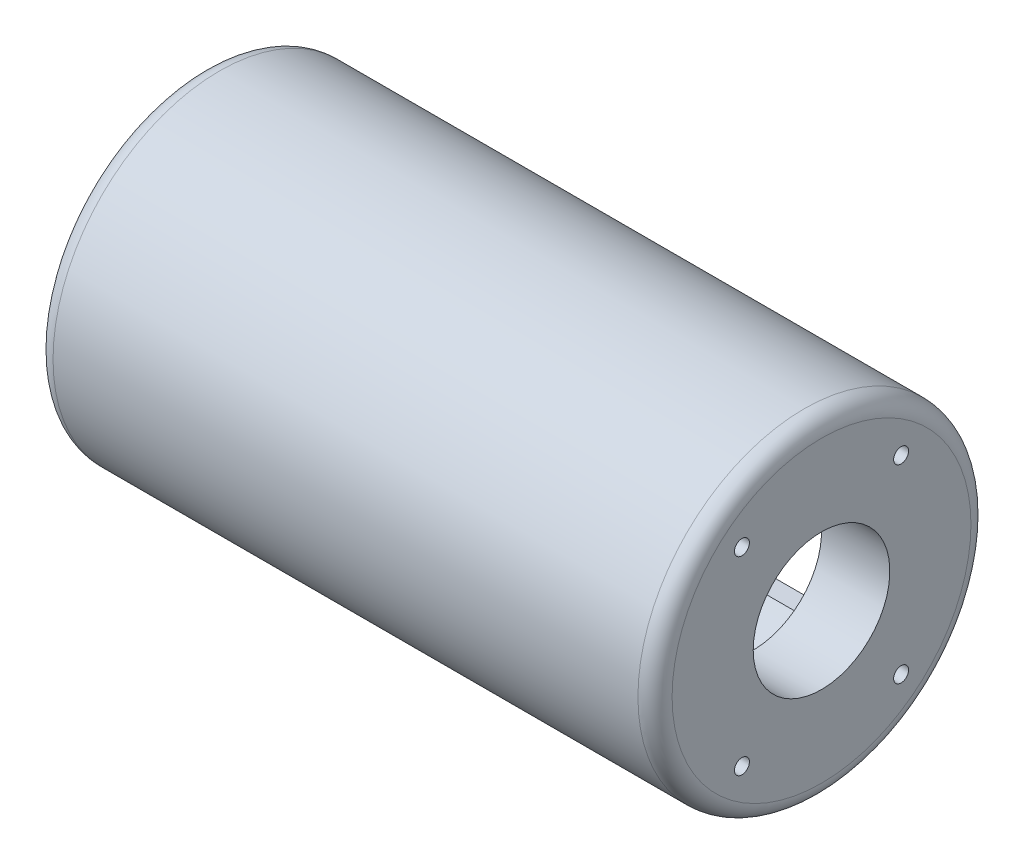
SolidWorks part; units mm, degrees
ref_plane "Face" through (0, 0, 0) normal (0, 0, 1) x (1, 0, 0)
ref_plane "Dessus" through (0, 0, 0) normal (0, 1, 0) x (1, 0, 0)
ref_plane "Droite" through (0, 0, 0) normal (1, 0, 0) x (0, 0, -1)
sketch "Esquisse1" plane through (0, 0, 0) normal (0, 0, 1) x (1, 0, 0)
  line L0 (0, 0) -> (122.7324, 0) construction
  line L1 (0, 6.5) -> (0, 39)
  line L2 (0, 39) -> (145, 39)
  line L3 (145, 39) -> (145, 16)
  line L4 (16, 36) -> (129, 36)
  line L5 (129, 36) -> (129, 16)
  line L6 (129, 16) -> (145, 16)
  line L7 (16, 36) -> (16, 6.5)
  line L8 (16, 6.5) -> (0, 6.5)
  dimension "D1" = 145
  dimension "D2" = 39
  dimension "D3" = 13
  dimension "D4" = 32
  dimension "D5" = 3
  dimension "D6" = 16
  dimension "D7" = 16
  dimension "D8" = 129
revolve "Base-Révolution" add sketch "Esquisse1" angle 360 about L0
fillet "Congé1" radius 4
sketch "Esquisse2" plane through (145, 0, 0) normal (1, 0, 0) x (0, 0, -1)
  line L0 (0, 57.3867) -> (0, -53.5947) construction
  line L1 (-57.0075, 0) -> (63.8333, 0) construction
  line L2 (0, 0) -> (37.2817, 44.4306) construction
  circle A0 centre (18.6408, 22.2153) radius 1.75
  circle A1 centre (-18.6408, 22.2153) radius 1.75
  circle A2 centre (18.6408, -22.2153) radius 1.75
  circle A3 centre (-18.6408, -22.2153) radius 1.75
  dimension "D1" = 3.5
  dimension "D2" = 29
  dimension "D3" = 40
extrude "Enlèv. mat.-Extru.1" cut sketch "Esquisse2" against normal blind 20
sketch "Esquisse3" plane through (0, 0, 0) normal (0, 0, 1) x (1, 0, 0)
  line L0 (0, 0) -> (151.9442, 0) construction
  line L2 (0, 35) -> (0, -35) construction
  line L3 (20, 27) -> (124.8721, 27)
  line L4 (17, 24) -> (17, -24)
  line L5 (20, -27) -> (124.8721, -27)
  line L6 (127.8721, -24) -> (127.8721, 24)
  arc A0 (20, 27) -> (17, 24) centre (20, 24) ccw
  arc A1 (127.8721, -24) -> (124.8721, -27) centre (124.8721, -24) cw
  arc A2 (124.8721, 27) -> (127.8721, 24) centre (124.8721, 24) cw
  arc A3 (20, -27) -> (17, -24) centre (20, -24) cw
  dimension "D4" = 3
  dimension "D5" = 3
  dimension "D1" = 27
  dimension "D2" = 27
  dimension "D3" = 17
extrude "Enlèv. mat.-Extru.2" cut sketch "Esquisse3" against normal blind 150
